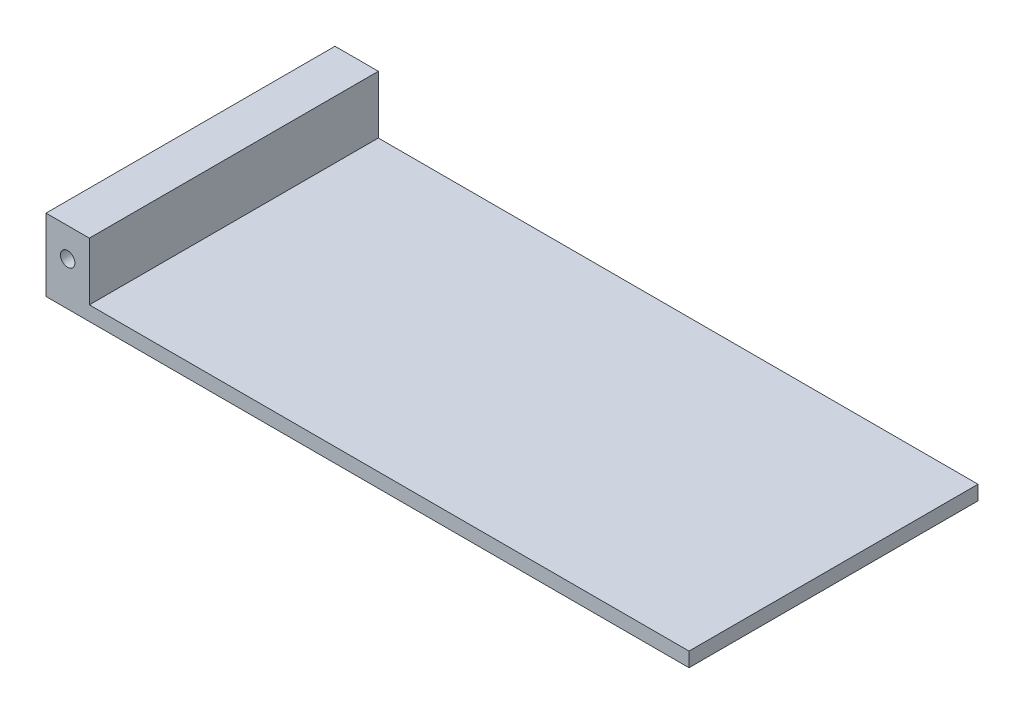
SolidWorks part; units mm, degrees
ref_plane "Front Plane" through (0, 0, 0) normal (0, 0, 1) x (1, 0, 0)
ref_plane "Top Plane" through (0, 0, 0) normal (0, 1, 0) x (1, 0, 0)
ref_plane "Right Plane" through (0, 0, 0) normal (1, 0, 0) x (0, 0, -1)
sketch "Sketch1" plane through (0, 0, 0) normal (0, 0, 1) x (1, 0, 0)
  line L1 (0, 0) -> (565.15, 0)
  line L2 (0, 0) -> (0, 12.7)
  line L3 (0, 12.7) -> (565.15, 12.7)
  line L4 (565.15, 0) -> (565.15, 12.7)
  dimension "D1" = 565.15
  dimension "D2" = 12.7
extrude "Extrude1" add sketch "Sketch1" along normal blind 254
sketch "Sketch7" plane through (0, 12.7, 0) normal (0, 1, 0) x (-1, 0, 0)
  line L1 (-565.15, 0) -> (0, 0) construction
  line L2 (0, 254) -> (-38.1, 254)
  line L3 (0, 254) -> (0, 0)
  line L4 (0, 0) -> (-38.1, 0)
  line L5 (-38.1, 254) -> (-38.1, 0)
  dimension "D1" = 38.1
extrude "Extrude4" add sketch "Sketch7" along normal blind 50.8
sketch "Sketch8" plane through (0, 0, 254) normal (0, 0, 1) x (1, 0, 0)
  line L11 (0, 63.5) -> (0, 0) construction
  line L16 (0, 63.5) -> (38.1, 63.5) construction
  circle A0 centre (19.05, 38.1) radius 6.35
  dimension "D1" = 12.7
  dimension "D2" = 19.05
  dimension "D3" = 25.4
extrude "Cut-Extrude5" cut sketch "Sketch8" against normal through all
